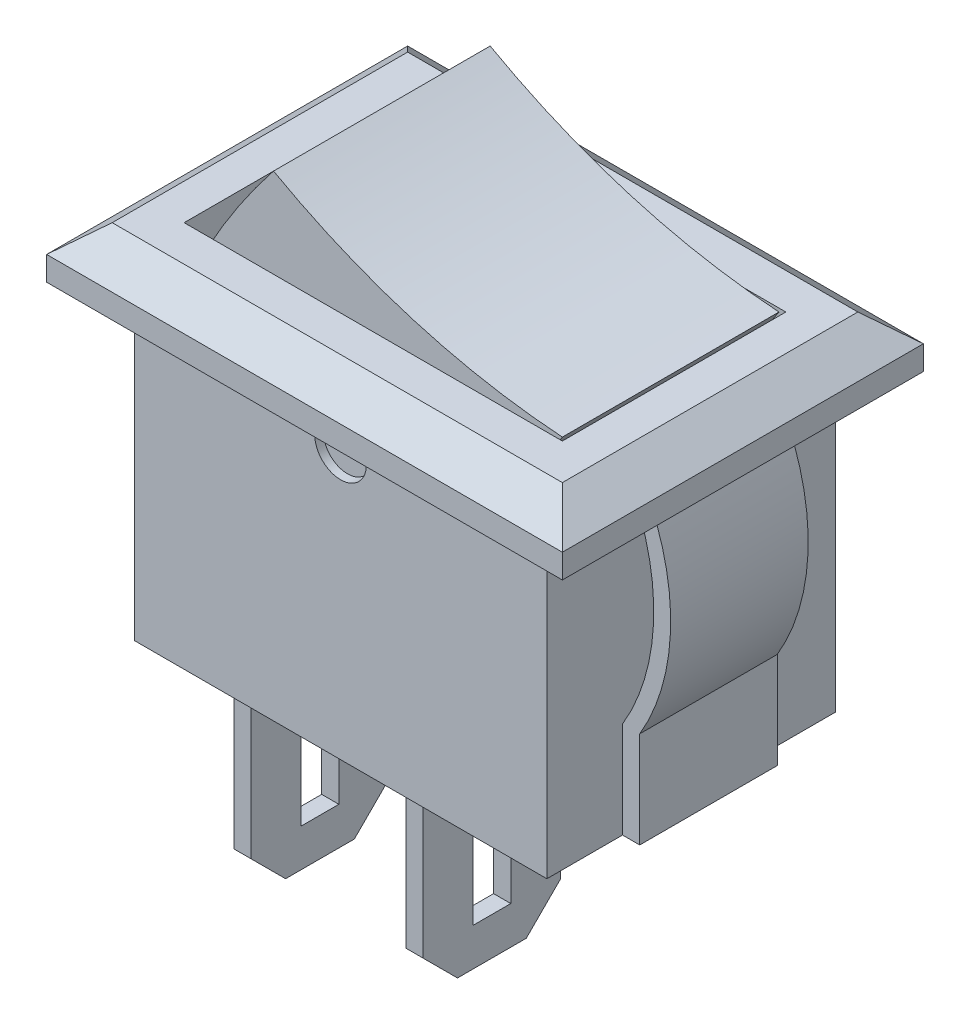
SolidWorks part; units mm, degrees
ref_plane "Alzado" through (0, 0, 0) normal (0, 0, 1) x (1, 0, 0)
ref_plane "Planta" through (0, 0, 0) normal (0, 1, 0) x (1, 0, 0)
ref_plane "Vista lateral" through (0, 0, 0) normal (1, 0, 0) x (0, 0, -1)
sketch "Croquis1" plane through (0, 0, 0) normal (0, 1, 0) x (1, 0, 0)
  line L1 (-6, -4.2) -> (6, -4.2)
  line L2 (-6, -4.2) -> (-6, 4.2)
  line L3 (-6, 4.2) -> (6, 4.2)
  line L4 (6, -4.2) -> (6, 4.2)
  line L5 (-6, -4.2) -> (6, 4.2) construction
  line L6 (-6, 4.2) -> (6, -4.2) construction
  point P0 (0, 0)
  dimension "D1" = 12
  dimension "D2" = 8.4
extrude "Saliente-Extruir1" add sketch "Croquis1" along normal blind 8.8
sketch "Croquis2" plane through (0, 8.8, 0) normal (0, 1, 0) x (1, 0, 0)
  line L1 (-7.5, -5.25) -> (7.5, -5.25)
  line L2 (-7.5, -5.25) -> (-7.5, 5.25)
  line L3 (-7.5, 5.25) -> (7.5, 5.25)
  line L4 (7.5, -5.25) -> (7.5, 5.25)
  line L5 (-7.5, -5.25) -> (7.5, 5.25) construction
  line L6 (-7.5, 5.25) -> (7.5, -5.25) construction
  point P0 (0, 0)
  dimension "D1" = 10.5
  dimension "D2" = 15
extrude "Saliente-Extruir2" add sketch "Croquis2" along normal blind 0.7
sketch "Croquis3" plane through (0, 9.5, 0) normal (0, 1, 0) x (1, 0, 0)
  line L4 (7.5, -5.25) -> (7.5, 5.25)
  line L5 (7.5, 5.25) -> (-7.5, 5.25)
  line L6 (-7.5, 5.25) -> (-7.5, -5.25)
  line L7 (-7.5, -5.25) -> (7.5, -5.25)
  line L8 (7.5, -5.25) -> (7.5, 5.25)
  line L9 (7.5, 5.25) -> (-7.5, 5.25)
  line L10 (-7.5, 5.25) -> (-7.5, -5.25)
  line L11 (-7.5, -5.25) -> (7.5, -5.25)
  dimension "D1" = 0
extrude "Saliente-Extruir3" add sketch "Croquis3" along normal blind 0.8 draft 50
sketch "Croquis6" plane through (0, 0, 0) normal (0, 0, 1) x (1, 0, 0)
  line L0 (0, 8.8) -> (0, 0) construction
  line L1 (-6, 8.8) -> (6, 8.8) construction
  line L2 (-7.5, 8.8) -> (7.5, 8.8) construction
  circle A0 centre (0, 7.8) radius 0.75
  point P7 (0, 0)
  dimension "D1" = 1.5
  dimension "D2" = 1
sketch "Croquis4" plane through (0, 10.3, 0) normal (0, 1, 0) x (1, 0, 0)
  line L1 (-5.5, -3.25) -> (5.5, -3.25)
  line L2 (-5.5, -3.25) -> (-5.5, 3.25)
  line L3 (-5.5, 3.25) -> (5.5, 3.25)
  line L4 (5.5, -3.25) -> (5.5, 3.25)
  line L5 (-5.5, -3.25) -> (5.5, 3.25) construction
  line L6 (-5.5, 3.25) -> (5.5, -3.25) construction
  point P0 (0, 0)
  dimension "D1" = 11
  dimension "D2" = 6.5
extrude "Cortar-Extruir1" cut sketch "Croquis4" against normal blind 9
extrude "Cortar-Extruir7" cut sketch "Croquis6" against normal through all both and the other way through all
sketch "Croquis5" plane through (0, 0, 0) normal (0, 0, 1) x (1, 0, 0)
  line L0 (5.4, 4.2389) -> (5.4, 13.5486) construction
  line L1 (5.5, 1.3) -> (5.5, 10.3) construction
  line L2 (-6.5466, 10.3) -> (6.5466, 10.3) construction
  line L3 (5.4, 10.3) -> (6.5466, 10.3) construction
  line L4 (-4.7, 12.0605) -> (-4.7, 6.3501) construction
  line L5 (-6.5466, 10.3) -> (-4.7, 10.3) construction
  line L6 (5.4, 10.3) -> (6.5466, 10.3) construction
  line L7 (-3, 10.3) -> (-3, 12.8) construction
  line L8 (-7.5, 9.5) -> (-7.5, 8.8) construction
  line L9 (-7.5, 8.8) -> (7.5, 8.8) construction
  line L10 (-7.5, 9.5) -> (7.5, 9.5) construction
  line L11 (-5.3, 12.0605) -> (-5.3, 9.1741) construction
  arc A0 (-3, 12.8) -> (5.4, 10.3) centre (6.7664, 30.2533) ccw
  arc A1 (-3, 12.8) -> (-5.3, 9.1741) centre (12.6412, 0.336) ccw
  circle A2 centre (0, 7.8) radius 0.75 construction
  arc A3 (-5.3, 9.1741) -> (5.4, 10.3) centre (-0.3757, 13.7827) ccw
  point P24 (0, 9.5)
  dimension "D1" = 40
  dimension "D3" = 40
  dimension "D7" = 1.5
  dimension "D2" = 0.1
  dimension "D4" = 0.8
  dimension "D5" = 2.5
  dimension "D6" = 4.5
  dimension "D8" = 1
  dimension "D9" = 0.2
extrude "Saliente-Extruir4" add sketch "Croquis5" along normal mid plane 6.3 separate body
sketch "Croquis7" plane through (0, 0, 0) normal (0, 0, 1) x (1, 0, 0)
  circle A0 centre (0, 7.8) radius 0.7
  dimension "D1" = 1.4
extrude "Saliente-Extruir5" add sketch "Croquis7" along normal mid plane 8
sketch "Croquis8" plane through (0, 0, 0) normal (0, 0, 1) x (1, 0, 0)
  line L0 (0, 8.8) -> (0, 0) construction
  line L1 (-6, 8.8) -> (6, 8.8) construction
  line L2 (-6, 0) -> (6, 0) construction
  line L3 (-6.5, 0) -> (-6.5, 2.8)
  line L4 (-6.5, 0) -> (-6, 0)
  line L6 (-6, 8.8) -> (-6, 0) construction
  line L7 (-6.3042, 8.8) -> (-6.8, 8.8)
  line L8 (-7.5, 8.8) -> (7.5, 8.8) construction
  line L9 (-0.956, 6.0847) -> (-7.4, 6.0847) construction
  line L11 (-6, 0) -> (-6, 2.8)
  line L12 (6.5, 0) -> (6, 0)
  line L13 (6.5, 0) -> (6.5, 2.8)
  line L14 (6.3042, 8.8) -> (6.8, 8.8)
  line L15 (6, 0) -> (6, 2.8)
  arc A0 (-6.8, 8.8) -> (-6.5, 2.8) centre (-0.956, 6.0847) ccw
  arc A1 (-6.3042, 8.8) -> (-6, 2.8) centre (-0.5094, 6.086) ccw
  arc A2 (6.8, 8.8) -> (6.5, 2.8) centre (0.956, 6.0847) cw
  arc A3 (6.3042, 8.8) -> (6, 2.8) centre (0.5094, 6.086) cw
  point P14 (0, 0)
  point P19 (-6.9, 5.7621)
  dimension "D1" = 6.5
  dimension "D2" = 6.8
  dimension "D3" = 7.4
  dimension "D4" = 2.8
  dimension "D5" = 0.4958
  dimension "D6" = 0.5
extrude "Saliente-Extruir6" add sketch "Croquis8" along normal mid plane 4
sketch "Croquis9" plane through (0, 0, 0) normal (0, -1, 0) x (1, 0, 0)
  line L0 (-6.5, 0) -> (6.5, 0) construction
  line L1 (-5.3, -2) -> (-4.8, -2)
  line L2 (-5.3, -2) -> (-5.3, 2)
  line L3 (-5.3, 2) -> (-4.8, 2)
  line L4 (-4.8, -2) -> (-4.8, 2)
  line L5 (-5.3, -2) -> (-4.8, 2) construction
  line L6 (-5.3, 2) -> (-4.8, -2) construction
  line L7 (-6.5, 2) -> (-6.5, -2) construction
  line L8 (6.5, 2) -> (6.5, -2) construction
  line L9 (-0.3, -2) -> (-0.3, 2)
  line L10 (-0.3, -2) -> (0.2, -2)
  line L11 (0.2, -2) -> (0.2, 2)
  line L12 (-0.3, 2) -> (0.2, 2)
  point P0 (-5.05, 0)
  dimension "D1" = 4
  dimension "D2" = 0.5
  dimension "D3" = 1.2
  dimension "D5" = 4.5
  dimension "D4" = 2
extrude "Saliente-Extruir7" add sketch "Croquis9" along normal blind 7 separate body
sketch "Croquis10" plane through (-5.3, 0, 0) normal (-1, 0, 0) x (0, 0, 1)
  line L0 (2, -7) -> (-2, -7) construction
  line L1 (-0.55, -3.3) -> (0.55, -3.3)
  line L2 (-0.55, -3.3) -> (-0.55, -5.9)
  line L3 (-0.55, -5.9) -> (0.55, -5.9)
  line L4 (0.55, -3.3) -> (0.55, -5.9)
  line L5 (-0.55, -3.3) -> (0.55, -5.9) construction
  line L6 (-0.55, -5.9) -> (0.55, -3.3) construction
  line L7 (-2, -6) -> (-1, -7)
  line L8 (-2, -7) -> (-2, 0) construction
  line L9 (-1, -7) -> (-2, -7)
  line L10 (-2, -7) -> (-2, -6)
  line L11 (2, -6) -> (1, -7)
  line L12 (2, -7) -> (2, 0) construction
  line L13 (1, -7) -> (2, -7)
  line L14 (2, -7) -> (2, -6)
  point P0 (0, -4.6)
  point P18 (0, 0)
  dimension "D1" = 1.1
  dimension "D2" = 2.6
  dimension "D3" = 1.1
  dimension "D4" = 45
  dimension "D5" = 1
extrude "Cortar-Extruir8" cut sketch "Croquis10" against normal through all both
